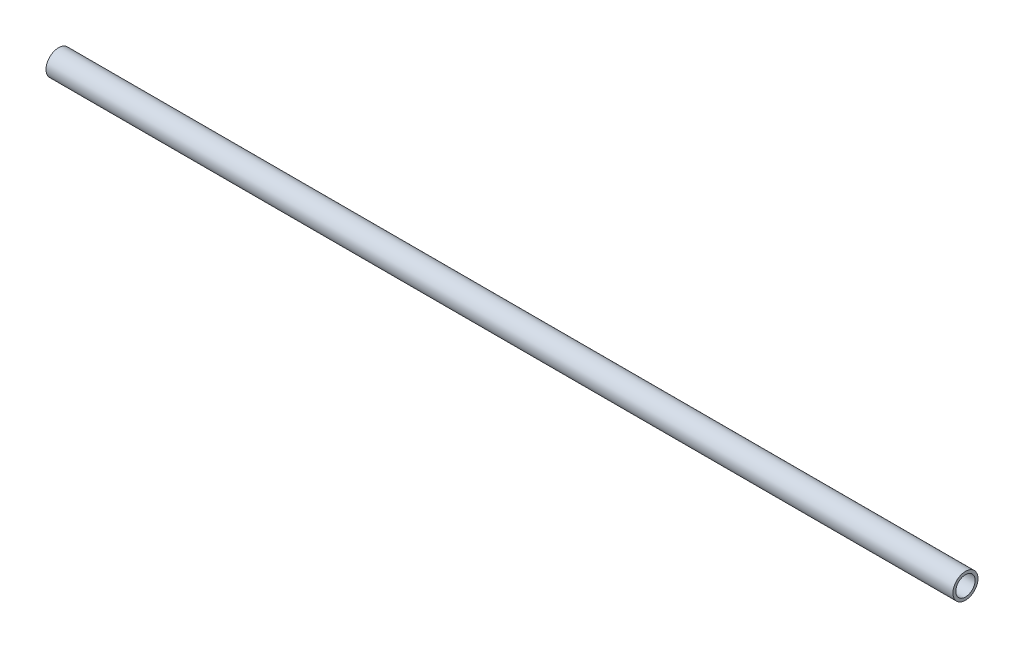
SolidWorks part; units mm, degrees
ref_plane "Front" through (0, 0, 0) normal (0, 0, 1) x (1, 0, 0)
ref_plane "Top" through (0, 0, 0) normal (0, 1, 0) x (1, 0, 0)
ref_plane "Right" through (0, 0, 0) normal (1, 0, 0) x (0, 0, -1)
sketch "Sketch1" plane through (0, 0, 0) normal (0, 0, 1) x (1, 0, 0)
  line L0 (0, 0) -> (1193.8, 0)
  line L1 (9.9848, 0) -> (-9.9848, 0) construction
  dimension "D1" = 1193.8
other "Structural Member1"
ref_plane "Plane1" through (0, 0, 0) normal (1, 0, 0) x (0, 0, -1)
sketch "Sketch11" plane through (0, 0, 0) normal (1, 0, 0) x (0, 0, -1)
  circle A0 centre (0, 0) radius 12.7
  circle A1 centre (0, 0) radius 16.51
  point P3 (0, 0)
  dimension "D1" = 33.02
  dimension "D2" = 25.4
